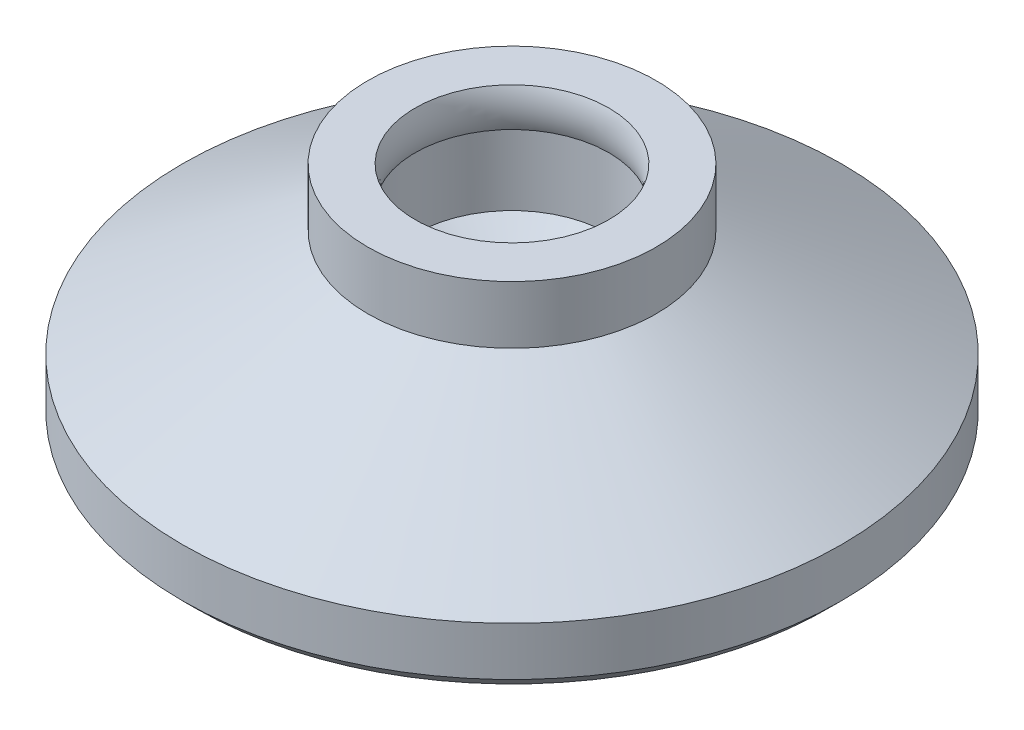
SolidWorks part; units mm, degrees
ref_plane "Front Plane" through (0, 0, 0) normal (0, 0, 1) x (1, 0, 0)
ref_plane "Top Plane" through (0, 0, 0) normal (0, 1, 0) x (1, 0, 0)
ref_plane "Right Plane" through (0, 0, 0) normal (1, 0, 0) x (0, 0, -1)
sketch "Sketch1" plane through (0, 0, 0) normal (0, 1, 0) x (1, 0, 0)
  circle A0 centre (0, 0) radius 7
  dimension "D1" = 14
extrude "Extrude1" add sketch "Sketch1" along normal mid plane 11
sketch "Sketch3" plane through (0, -5.5, 0) normal (0, -1, 0) x (1, 0, 0)
  circle A0 centre (0, 0) radius 16
  dimension "D1" = 32
extrude "Extrude2" add sketch "Sketch3" against normal blind 3
sketch "Sketch4" plane through (0, 0, 0) normal (0, 0, 1) x (1, 0, 0)
  line L0 (-16, -2.5) -> (-7, 2.6962)
  line L1 (-7, 5.5) -> (-7, -2.5) construction
  line L2 (-7, 2.6962) -> (-7, -2.5)
  line L3 (-7, -2.5) -> (-16, -2.5)
  dimension "D1" = 30
revolve "Revolve1" add sketch "Sketch4" angle 360 about axis through (0, 5.5, 0) along (0, -1, 0)
chamfer "Chamfer1" distance 0.64 angle 45 1 edges at (0, -5.5, -16)
sketch "Sketch5" plane through (0, 0, 0) normal (0, 0, 1) x (1, 0, 0)
  line L1 (0, 0) -> (0, 11.3083) construction
  line L2 (0, 5.5) -> (4.7, 5.5)
  line L3 (7, 5.5) -> (-7, 5.5) construction
  line L4 (4.7, 3.62) -> (4.7, 0.2135)
  line L5 (4.7, 0.2135) -> (0, -2.5)
  line L6 (0, -2.5) -> (0, 5.5)
  line L7 (16, -2.5) -> (-16, -2.5) construction
  arc A0 (4.7, 5.5) -> (4.7, 3.62) centre (6.956, 4.56) ccw
  point P14 (4.512, 4.56)
  dimension "D2" = 9.4
  dimension "D1" = 60
  dimension "D3" = 1.88
  dimension "D4" = 0.188
revolve "Cut-Revolve1" cut sketch "Sketch5" angle 360 about L1
equation "\"D3@Sketch5\" = \"D2@Sketch5\"*0.2"
equation "\"D4@Sketch5\" = \"D3@Sketch5\"*0.1"
